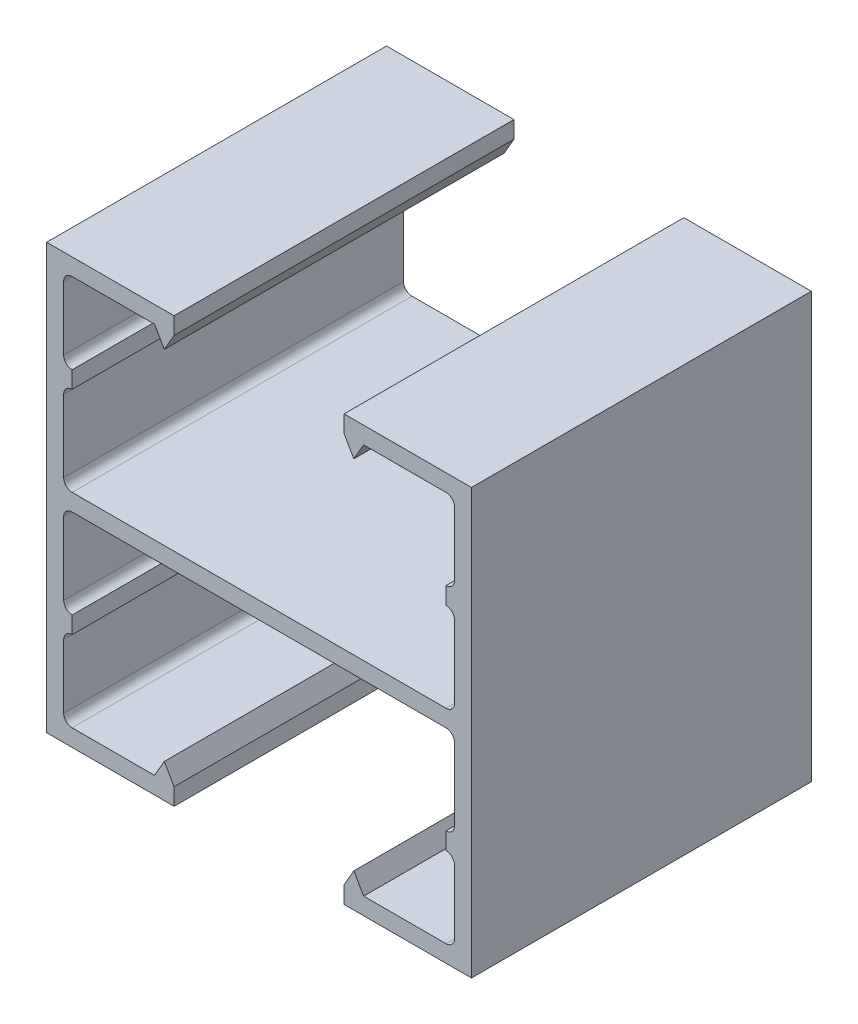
SolidWorks part; units mm, degrees
ref_plane "Plane1" through (0, 0, 0) normal (0, 0, 1) x (1, 0, 0)
ref_plane "Plane2" through (0, 0, 0) normal (0, 1, 0) x (1, 0, 0)
ref_plane "Plane3" through (0, 0, 0) normal (1, 0, 0) x (0, 0, -1)
sketch "Sketch1" plane through (0, 0, 0) normal (0, 0, 1) x (1, 0, 0)
  line L0 (-6.35, 15.875) -> (-15.875, 15.875)
  line L1 (-15.875, 15.875) -> (-15.875, -15.875)
  line L2 (-7.8165, -14.605) -> (-13.97, -14.605)
  line L3 (15.875, -15.875) -> (15.875, 15.875)
  line L4 (15.875, 15.875) -> (6.35, 15.875)
  line L5 (13.97, 14.605) -> (7.8165, 14.605)
  line L6 (14.605, 1.27) -> (14.605, 7.3025)
  line L7 (-13.97, 0.635) -> (13.97, 0.635)
  line L8 (-14.605, 13.97) -> (-14.605, 8.5725)
  line L9 (-7.8165, 14.605) -> (-13.97, 14.605)
  line L10 (7.8165, 14.605) -> (7.0832, 13.335)
  line L11 (7.0832, 13.335) -> (6.35, 14.605)
  line L12 (6.35, 14.605) -> (6.35, 15.875)
  line L13 (-7.8165, 14.605) -> (-7.0832, 13.335)
  line L14 (-7.0832, 13.335) -> (-6.35, 14.605)
  line L15 (-6.35, 14.605) -> (-6.35, 15.875)
  line L16 (22.86, 0) -> (-25.4, 0) construction
  line L17 (7.0832, -13.335) -> (6.35, -14.605)
  line L18 (7.8165, -14.605) -> (7.0832, -13.335)
  line L19 (13.97, -14.605) -> (7.8165, -14.605)
  line L20 (15.875, -15.875) -> (6.35, -15.875)
  line L21 (6.35, -14.605) -> (6.35, -15.875)
  line L22 (-6.35, -15.875) -> (-15.875, -15.875)
  line L23 (-6.35, -14.605) -> (-6.35, -15.875)
  line L24 (-7.0832, -13.335) -> (-6.35, -14.605)
  line L25 (-7.8165, -14.605) -> (-7.0832, -13.335)
  line L26 (-14.605, -13.97) -> (-14.605, -8.5725)
  line L27 (14.605, -1.27) -> (14.605, -7.3025)
  line L28 (-13.97, -0.635) -> (13.97, -0.635)
  line L29 (-14.605, 8.5725) -> (-13.97, 8.5725)
  line L30 (-13.97, 8.5725) -> (-13.97, 7.3025)
  line L31 (-13.97, 7.3025) -> (-14.605, 7.3025)
  line L32 (-14.605, 7.3025) -> (-14.605, 1.27)
  line L33 (14.605, 8.5725) -> (13.97, 8.5725)
  line L34 (13.97, 8.5725) -> (13.97, 7.3025)
  line L35 (13.97, 7.3025) -> (14.605, 7.3025)
  line L36 (14.605, 8.5725) -> (14.605, 13.97)
  line L37 (13.97, -7.3025) -> (14.605, -7.3025)
  line L38 (13.97, -8.5725) -> (13.97, -7.3025)
  line L39 (14.605, -8.5725) -> (13.97, -8.5725)
  line L40 (-13.97, -7.3025) -> (-14.605, -7.3025)
  line L41 (-13.97, -8.5725) -> (-13.97, -7.3025)
  line L42 (-14.605, -8.5725) -> (-13.97, -8.5725)
  line L43 (14.605, -8.5725) -> (14.605, -13.97)
  line L44 (-14.605, -7.3025) -> (-14.605, -1.27)
  arc A0 (-14.605, 1.27) -> (-13.97, 0.635) centre (-13.97, 1.27) ccw
  arc A1 (-13.97, 14.605) -> (-14.605, 13.97) centre (-13.97, 13.97) ccw
  arc A2 (14.605, 13.97) -> (13.97, 14.605) centre (13.97, 13.97) ccw
  arc A3 (13.97, 0.635) -> (14.605, 1.27) centre (13.97, 1.27) ccw
  arc A4 (14.605, -13.97) -> (13.97, -14.605) centre (13.97, -13.97) cw
  arc A5 (-13.97, -14.605) -> (-14.605, -13.97) centre (-13.97, -13.97) cw
  arc A6 (13.97, -0.635) -> (14.605, -1.27) centre (13.97, -1.27) cw
  arc A7 (-14.605, -1.27) -> (-13.97, -0.635) centre (-13.97, -1.27) cw
  dimension "D5" = 0.635
  dimension "D3" = 15.875
  dimension "D4" = 60
  dimension "D6" = 8.5725
  dimension "Width" = 31.75
  dimension "Height" = 31.75
  dimension "D8" = 15.875
  dimension "D10" = 12.7
  dimension "edge" = 9.525
  dimension "D13" = 0.7332
  dimension "D1" = 0.635
extrude "Base-Extrude" add sketch "Sketch1" along normal mid plane 25.4
fillet "Fillet1" radius 0.635 8 edges at (14.605, 8.5725, 0) (14.605, -7.3025, 0) (-14.605, 8.5725, 0) (-14.605, -7.3025, 0) (-14.605, 7.3025, 0) (-14.605, -8.5725, 0) (14.605, 7.3025, 0) (14.605, -8.5725, 0)
equation "\"D8@Sketch1\" = \"Width@Sketch1\" / 2"
equation "\"D10@Sketch1\" = \"Width@Sketch1\" - 2 * \"edge@Sketch1\""
equation "\"D5@Sketch1\" = \"gauge@Sketch1\" / 2"
equation "\"D3@Sketch1\" = \"Height@Sketch1\" / 2"
equation "\"D1@Sketch1\" = \"D5@Sketch1\""
equation "\"D6@Sketch1\" = \"D3@Sketch1\" / 2 + \"D5@Sketch1\""
equation "\"D1@Fillet1\" = \"D5@Sketch1\""
equation "\"D13@Sketch1\" = \"gauge@Sketch1\" * .577350269"
